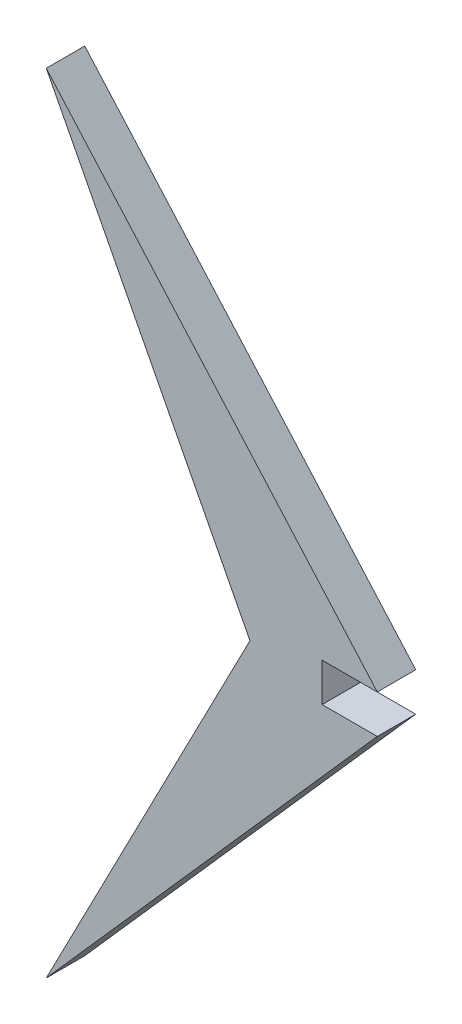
SolidWorks part; units mm, degrees
ref_plane "Спереди" through (0, 0, 0) normal (0, 0, 1) x (1, 0, 0)
ref_plane "Сверху" through (0, 0, 0) normal (0, 1, 0) x (1, 0, 0)
ref_plane "Справа" through (0, 0, 0) normal (1, 0, 0) x (0, 0, -1)
sketch "Model" plane through (0, 0, 0) normal (0, 0, 1) x (1, 0, 0)
  line L0 (142.6424, 181.9152) -> (185, 100)
  line L1 (185, 100) -> (142.6424, 18.0848)
  line L2 (200, 104) -> (200, 96)
  line L3 (211.4667, 104) -> (142.6424, 181.9152)
  line L4 (142.6424, 18.0848) -> (211.4667, 96)
  line L5 (200, 96) -> (211.4667, 96)
  line L6 (200, 104) -> (211.4667, 104)
extrude "Бобышка-Вытянуть1" add sketch "Model" along normal blind 8
